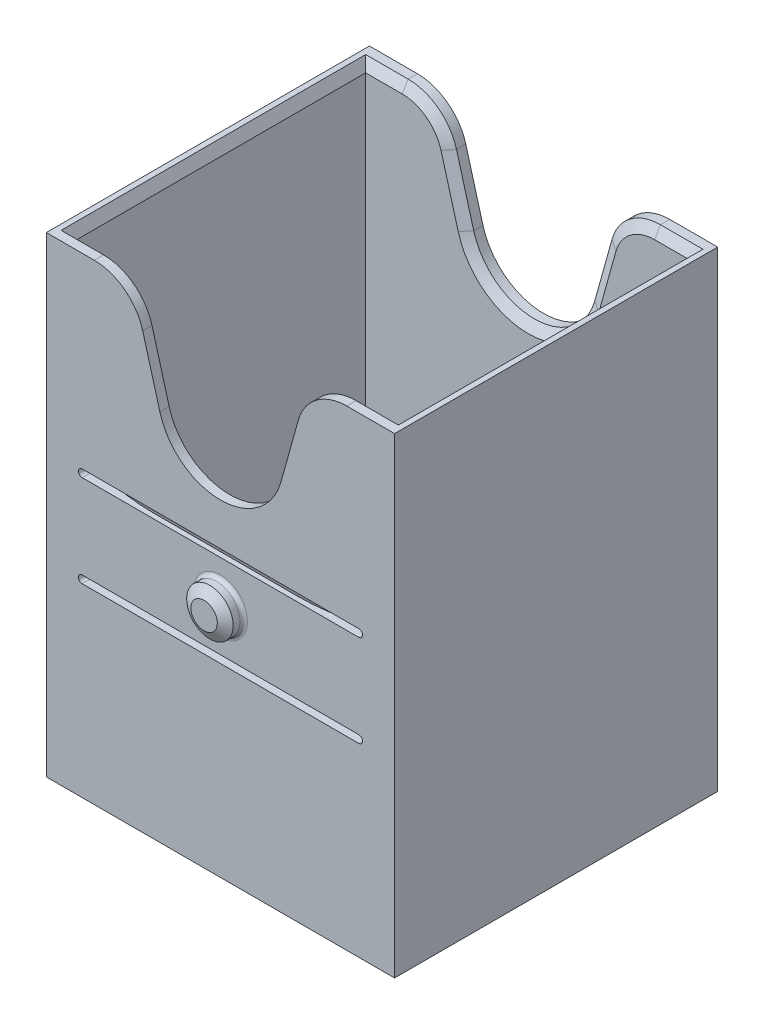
SolidWorks part; units mm, degrees
ref_plane "Front Plane" through (0, 0, 0) normal (0, 0, 1) x (1, 0, 0)
ref_plane "Top Plane" through (0, 0, 0) normal (0, 1, 0) x (1, 0, 0)
ref_plane "Right Plane" through (0, 0, 0) normal (1, 0, 0) x (0, 0, -1)
sketch "Sketch1" plane through (0, 0, 0) normal (0, 1, 0) x (1, 0, 0)
  line L0 (32.893, 0) -> (-32.893, 0)
  line L1 (-31.623, -28.321) -> (31.623, -28.321) construction
  line L2 (-31.623, -28.321) -> (-31.623, 0) construction
  line L4 (31.623, -28.321) -> (31.623, 0) construction
  line L5 (-31.623, -28.321) -> (0, 0) construction
  line L6 (0, 0) -> (31.623, -28.321) construction
  line L7 (-32.893, -29.591) -> (32.893, -29.591)
  line L8 (-32.893, -29.591) -> (-32.893, 0)
  line L10 (32.893, -29.591) -> (32.893, 0)
  line L11 (0, -55) -> (0, 55) construction
  point P0 (0, 0)
  point P6 (0, 0)
  point P20 (0, 0)
  dimension "D1" = 29.591
  dimension "D2" = 65.786
  dimension "D3" = 1.27
  dimension "D4" = 1.27
extrude "Boss-Extrude2" add sketch "Sketch1" along normal blind 92.583 contours L8 L0 L10 L7
shell "Shell2" thickness 2.286
sketch "Sketch2" plane through (0, 0, 32.639) normal (0, 0, 1) x (1, 0, 0)
  line L0 (-17.78, 92.583) -> (-12.2346, 72.6665)
  line L1 (12.2346, 72.6665) -> (17.78, 92.583)
  line L2 (0, 76.073) -> (0, 92.583) construction
  line L3 (-35.179, 92.583) -> (35.179, 92.583) construction
  line L4 (-17.78, 92.583) -> (17.78, 92.583)
  arc A0 (-12.2346, 72.6665) -> (12.2346, 72.6665) centre (0, 76.073) ccw
  dimension "D2" = 29.21
  dimension "D3" = 12.7
  dimension "D1" = 35.56
extrude "Cut-Extrude1" cut sketch "Sketch2" against normal through all both and the other way through all
fillet "Fillet1" radius 10.16 2 edges at (-17.78, 92.583, 31.115) (17.78, 92.583, 31.115)
sketch "Sketch3" plane through (0, 0, 32.639) normal (0, 0, 1) x (1, 0, 0)
  line L0 (0, -17.9515) -> (0, 17.9515) construction
  line L1 (17.9515, 0) -> (-17.9515, 0) construction
  circle A1 centre (0, 44.8077) radius 4.699
  dimension "D1" = 9.398
  dimension "D2" = 44.8077
extrude "Boss-Extrude3" add sketch "Sketch3" along normal blind 3.302
chamfer "Chamfer1" distance 2.032 angle 30 1 edges at (4.699, 44.8077, 35.941)
sketch "Sketch4" plane through (0, 0, 32.639) normal (0, 0, 1) x (1, 0, 0)
  line L2 (-27.94, 53.3214) -> (27.94, 53.3214)
  line L3 (0, 51.2894) -> (0, 48.5522) construction
  line L6 (27.94, 54.8454) -> (-27.94, 54.8454)
  line L11 (27.94, 53.3214) -> (27.94, 54.8454) construction
  line L12 (0, 49.7607) -> (0, 51.2847) construction
  arc A5 (27.94, 53.3214) -> (27.94, 54.8454) centre (27.94, 54.0834) ccw
  arc A22 (-27.94, 53.3214) -> (-27.94, 54.8454) centre (-27.94, 54.0834) cw
  point P0 (-3.7088, 46.9746)
  point P2 (5.5867, 46.5157)
  point P7 (3.8593, 44.8077)
  point P16 (-4.826, 44.8077)
  point P29 (4.8343, 47.3477)
  dimension "D3" = 1.524
  dimension "D2" = 27.94
  dimension "D4" = 2.032
extrude "Cut-Extrude2" cut sketch "Sketch4" against normal up to next
ref_plane "Plane1" through (0, 44.8077, 0) normal (0, -1, 0) x (0, 0, -1)
ref_plane "Plane2" through (0, 5.08, 0) normal (0, 1, 0) x (1, 0, 0)
sketch "Sketch8" plane through (0, 5.08, 0) normal (0, 1, 0) x (1, 0, 0)
  line L0 (-60.071, -25.019) -> (-34.671, -25.019) construction
  line L2 (-35.179, -32.639) -> (35.179, -32.639) construction
  line L3 (-35.179, -32.639) -> (-35.179, 0) construction
  dimension "D1" = 25.4
  dimension "D2" = 7.62
  dimension "D3" = 0.508
sketch "Sketch9" plane through (0, 5.08, 0) normal (0, 1, 0) x (1, 0, 0)
  line L0 (-47.371, -37.719) -> (-47.371, -25.019)
  line L2 (-60.071, -25.019) -> (-34.671, -25.019) construction
  line L3 (-47.371, -25.019) -> (-34.671, -25.019)
  arc A0 (-47.371, -37.719) -> (-34.671, -25.019) centre (-47.371, -25.019) ccw
  point P17 (-47.371, -25.019)
revolve "Cut-Revolve5" [suppressed] cut sketch "Sketch9" angle 360 about L0
fillet "Fillet5" [suppressed] radius 17.78
mirror "Mirror1" about plane through (0, 44.8077, 0) normal (0, -1, 0) of "Cut-Extrude2"
sketch "Sketch5" plane through (0, 44.8077, 0) normal (0, -1, 0) x (0, 0, -1)
  line L0 (-29.591, 27.94) -> (-31.623, 19.05)
  line L1 (-29.591, 15.7099) -> (-29.591, 25.4976) construction
  line L2 (-31.623, 19.05) -> (-31.623, -19.05)
  line L3 (-31.623, -19.05) -> (-29.591, -27.94)
  line L4 (-32.639, -35.179) -> (-32.639, 35.179) construction
  line L5 (-29.591, -27.94) -> (-29.591, 27.94)
  line L6 (37.719, 0) -> (-37.719, 0) construction
  point P10 (-29.591, 0)
  dimension "D1" = 55.88
  dimension "D2" = 1.016
  dimension "D3" = 38.1
extrude "Cut-Extrude3" cut sketch "Sketch5" against normal up to next and the other way up to next
fillet "Fillet2" radius 38.1 2 edges at (-19.05, 44.8077, 31.623) (19.05, 44.8077, 31.623)
fillet "Fillet3" radius 0.762 1 edges at (-4.699, 44.8077, 32.639)
chamfer "Chamfer3" distance 2.032 angle 30 9 edges at (-32.893, 92.583, 14.7955) (-29.1953, 92.583, 29.591) (-19.352, 90.5135, 29.591) (-13.9723, 78.9073, 29.591) (0, 63.373, 29.591) (13.9723, 78.9073, 29.591) (19.352, 90.5135, 29.591) (29.1953, 92.583, 29.591) (32.893, 92.583, 14.7955)
chamfer "Chamfer4" distance 2.032 angle 30 3 edges at (28.702, 35.532, 29.591) (-28.702, 35.532, 29.591) (0, 34.77, 29.591)
mirror "Mirror4" [suppressed]
mirror "Mirror10" about plane through (32.893, 92.583, 0) normal (0, 0, 1) of "Chamfer3", "Fillet1", "Cut-Extrude1", "Shell2", "Boss-Extrude2"
sketch "Sketch6" plane through (0, -2.286, 0) normal (0, -1, 0) x (1, 0, 0)
  line L4 (35.179, 32.639) -> (-35.179, 32.639)
  line L5 (-35.179, 32.639) -> (-35.179, -32.639)
  line L6 (-35.179, -32.639) -> (35.179, -32.639)
  line L7 (35.179, -32.639) -> (35.179, 32.639)
  line L8 (35.179, 32.639) -> (-35.179, 32.639)
  line L9 (-35.179, 32.639) -> (-35.179, -32.639)
  line L11 (35.179, -32.639) -> (35.179, 32.639)
  line L21 (-35.179, -32.639) -> (35.179, -32.639)
  dimension "D1" = 0
extrude "Boss-Extrude4" add sketch "Sketch6" along normal blind 0.381
other "Fill Pattern4" [suppressed] parameters "D5"=0, "D6"=0, "D1"=11.684, "D2"=60, "D3"=1.27, "D9"=42, "D7"=11, "D8"=7
mirror "Mirror14" [suppressed] about plane through (0, 0, 0) normal (1, 0, 0)
